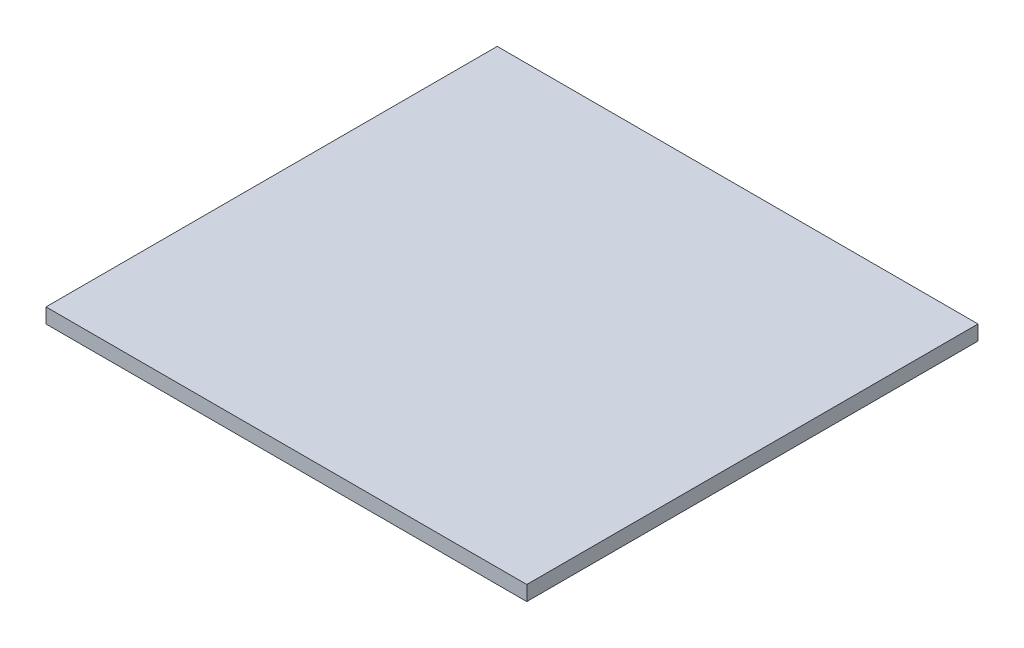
SolidWorks part; units mm, degrees
ref_plane "Front Plane" through (0, 0, 0) normal (0, 0, 1) x (1, 0, 0)
ref_plane "Top Plane" through (0, 0, 0) normal (0, 1, 0) x (1, 0, 0)
ref_plane "Right Plane" through (0, 0, 0) normal (1, 0, 0) x (0, 0, -1)
sketch "Sketch2" plane through (0, 0, 0) normal (0, 1, 0) x (1, 0, 0)
  line L1 (-66.5067, 60) -> (14.4933, 60)
  line L2 (-66.5067, 60) -> (-66.5067, -16.02)
  line L3 (-66.5067, -16.02) -> (14.4933, -16.02)
  line L4 (14.4933, 60) -> (14.4933, -16.02)
  line L5 (-66.5067, 60) -> (14.4933, -16.02) construction
  line L6 (-66.5067, -16.02) -> (14.4933, 60) construction
  point P0 (-26.0067, 21.99)
  dimension "D1" = 76.02
  dimension "D2" = 81
extrude "Boss-Extrude1" add sketch "Sketch2" along normal blind 2.5
